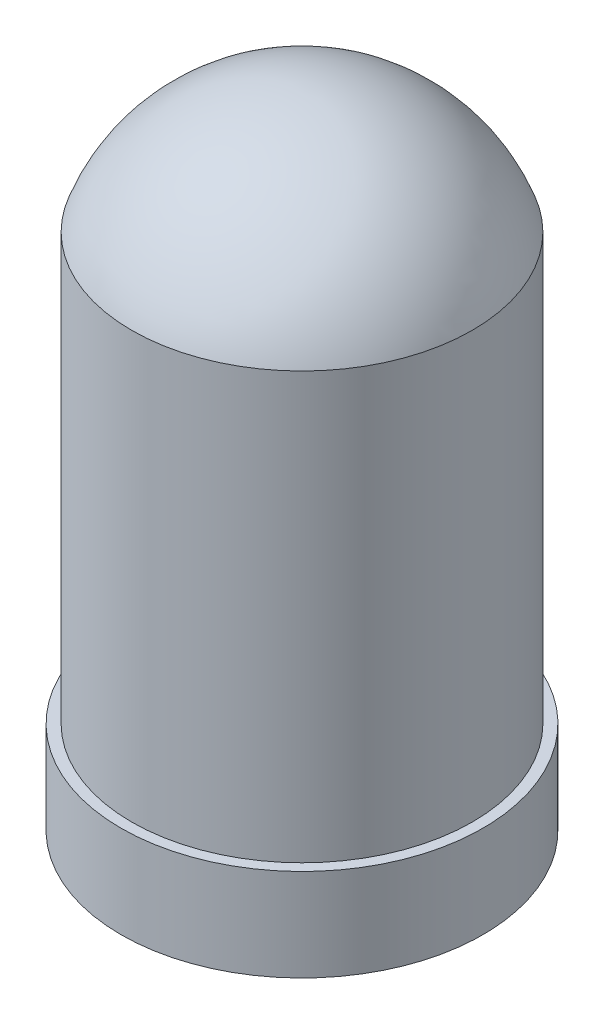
SolidWorks part; units mm, degrees
ref_plane "Front Plane" through (0, 0, 0) normal (0, 0, 1) x (1, 0, 0)
ref_plane "Top Plane" through (0, 0, 0) normal (0, 1, 0) x (1, 0, 0)
ref_plane "Right Plane" through (0, 0, 0) normal (1, 0, 0) x (0, 0, -1)
sketch "Sketch1" plane through (0, 0, 0) normal (0, 0, 1) x (1, 0, 0)
  line L0 (0, 0) -> (2.55, 0)
  line L1 (2.55, 0) -> (2.55, 1.3)
  line L2 (2.55, 1.3) -> (2.4, 1.3)
  line L3 (2.4, 1.3) -> (2.4, 7.3)
  line L4 (0, 0) -> (0, 9)
  arc A0 (2.4, 7.3) -> (-2.4, 7.3) centre (0, 6.4559) ccw
  point P8 (0, 9)
  point P11 (0, 9)
  dimension "D1" = 2.55
  dimension "D5" = 9
  dimension "D2" = 1.3
  dimension "D3" = 2.4
  dimension "D4" = 6
revolve "Revolve1" add sketch "Sketch1" angle 360 about L4
